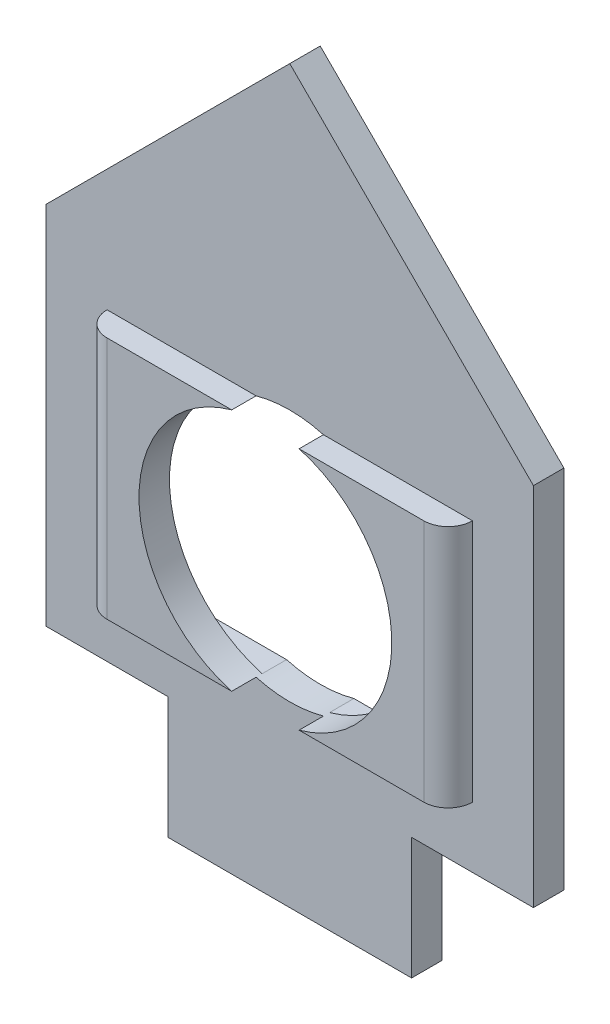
SolidWorks part; units mm, degrees
ref_plane "Plan1" through (0, 0, 0) normal (0, 0, 1) x (1, 0, 0)
ref_plane "Plan2" through (0, 0, 0) normal (0, 1, 0) x (1, 0, 0)
ref_plane "Plan3" through (0, 0, 0) normal (1, 0, 0) x (0, 0, -1)
sketch "Esquisse1" plane through (0, 0, 0) normal (0, 0, 1) x (1, 0, 0)
  line L0 (0, 70) -> (0, -70) construction
  line L2 (-4, 0) -> (4, 0)
  line L3 (4, 0) -> (4, 4)
  line L4 (4, 4) -> (8, 4)
  line L5 (8, 4) -> (8, 16)
  line L6 (8, 16) -> (0, 24)
  line L7 (-4, 0) -> (-4, 4)
  line L8 (-4, 4) -> (-8, 4)
  line L9 (-8, 4) -> (-8, 16)
  line L10 (-8, 16) -> (0, 24)
  point P12 (0, 0)
  dimension "D1" = 8
  dimension "D2" = 16
  dimension "D3" = 24
  dimension "D4" = 4
  dimension "D5" = 45
extrude "Base-Extrusion" add sketch "Esquisse1" along normal blind 1
sketch "Esquisse2" plane through (0, 0, 1) normal (0, 0, 1) x (1, 0, 0)
  line L0 (6, 6) -> (-6, 6)
  line L1 (6, 14) -> (-6, 14)
  line L2 (-6, 6) -> (-6, 14)
  line L3 (6, 14) -> (6, 6)
  line L4 (-10, 10) -> (10, 10) construction
  point P1 (-6, 10)
  point P8 (6, 10)
  dimension "D1" = 8
extrude "Boss.-Extru.1" add sketch "Esquisse2" along normal blind 0.8
sketch "Esquisse5" plane through (0, 0, 0) normal (0, 0, -1) x (-1, 0, 0)
  line L1 (-6, 14) -> (6, 14)
  line L2 (-6, 14) -> (-6, 6)
  line L3 (-6, 6) -> (6, 6)
  line L4 (6, 14) -> (6, 6)
extrude "Enlèv. mat.-Extru.2" cut sketch "Esquisse5" against normal blind 0.8
fillet "Congé2" radius 0.8
sketch "Esquisse6" plane through (0, 0, 0.8) normal (0, 0, -1) x (-1, 0, 0)
  circle A0 centre (0, 10) radius 4.15
  dimension "D1" = 8.3
extrude "Enlèv. mat.-Extru.6" cut sketch "Esquisse6" against normal mid plane 10.8
